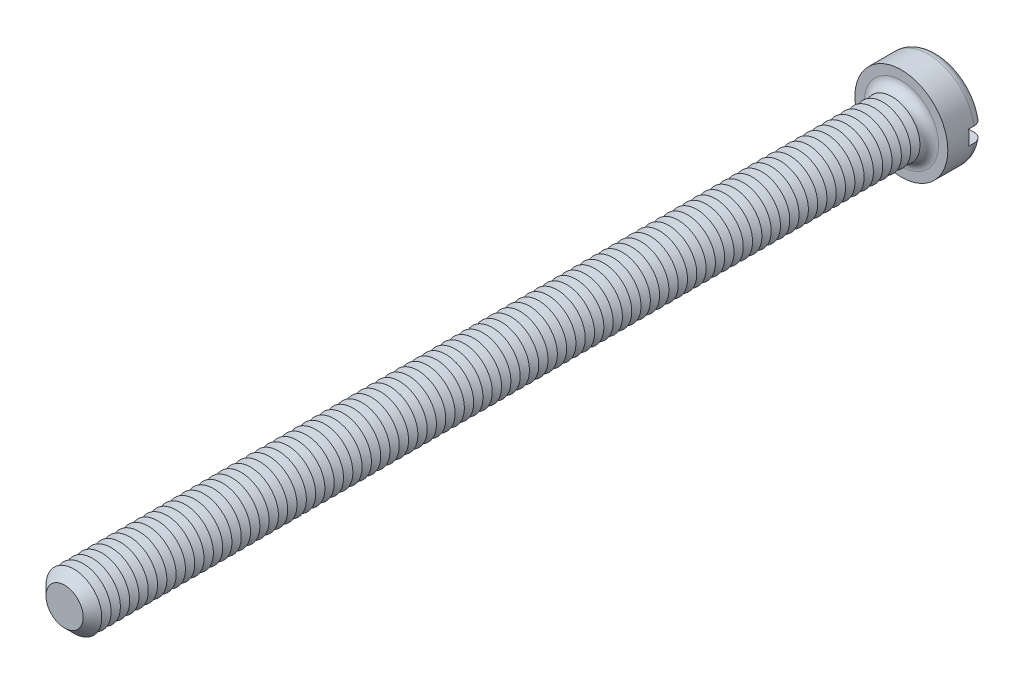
SolidWorks part; units mm, degrees
ref_plane "Front Plane" through (0, 0, 0) normal (0, 0, 1) x (1, 0, 0)
ref_plane "Top Plane" through (0, 0, 0) normal (0, 1, 0) x (1, 0, 0)
ref_plane "Right Plane" through (0, 0, 0) normal (1, 0, 0) x (0, 0, -1)
sketch "Sketch3" plane through (0, 0, 0) normal (0, 0, 1) x (1, 0, 0)
  circle A0 centre (0, 0) radius 5
  dimension "D1" = 10
extrude "Boss-Extrude2" add sketch "Sketch3" against normal blind 3.9
sketch "Sketch4" plane through (0, 0, 0) normal (0, 0, 1) x (1, 0, 0)
  circle A0 centre (0, 0) radius 3
  dimension "D1" = 6
extrude "Boss-Extrude3" add sketch "Sketch4" along normal blind 90
fillet "Fillet1" radius 1 2 edges at (5, 0, -3.9) (3, 0, 0)
chamfer "Chamfer1" distance 1 angle 45 1 edges at (3, 0, 90)
sketch "Sketch5" plane through (0, 0, 0) normal (1, 0, 0) x (0, 0, -1)
  line L0 (1.6944, 0) -> (-7.6738, 0) construction
sketch "Sketch6" plane through (0, 0, 0) normal (1, 0, 0) x (0, 0, -1)
  line L0 (-1, 3) -> (-1.5, 2.134)
  line L1 (-1.5, 2.134) -> (-2, 3)
  line L2 (-1, 3) -> (-89, 3) construction
  line L3 (-2, 3) -> (-1, 3)
  dimension "D1" = 1
revolve "Cut-Revolve1" cut sketch "Sketch6" angle 360 about L0
pattern_linear "LPattern1" count 88 spacing 1 along (0, 0, 1) of "Cut-Revolve1"
sketch "Sketch8" plane through (0, 0, -3.9) normal (0, 0, -1) x (-1, 0, 0)
  line L1 (5, -0.8) -> (-5, -0.8)
  line L2 (5, -0.8) -> (5, 0.8)
  line L3 (5, 0.8) -> (-5, 0.8)
  line L4 (-5, -0.8) -> (-5, 0.8)
  line L5 (5, -0.8) -> (-5, 0.8) construction
  line L6 (5, 0.8) -> (-5, -0.8) construction
  point P0 (0, 0)
  dimension "D1" = 10
  dimension "D2" = 1.6
extrude "Cut-Extrude1" cut sketch "Sketch8" against normal blind 1.6
